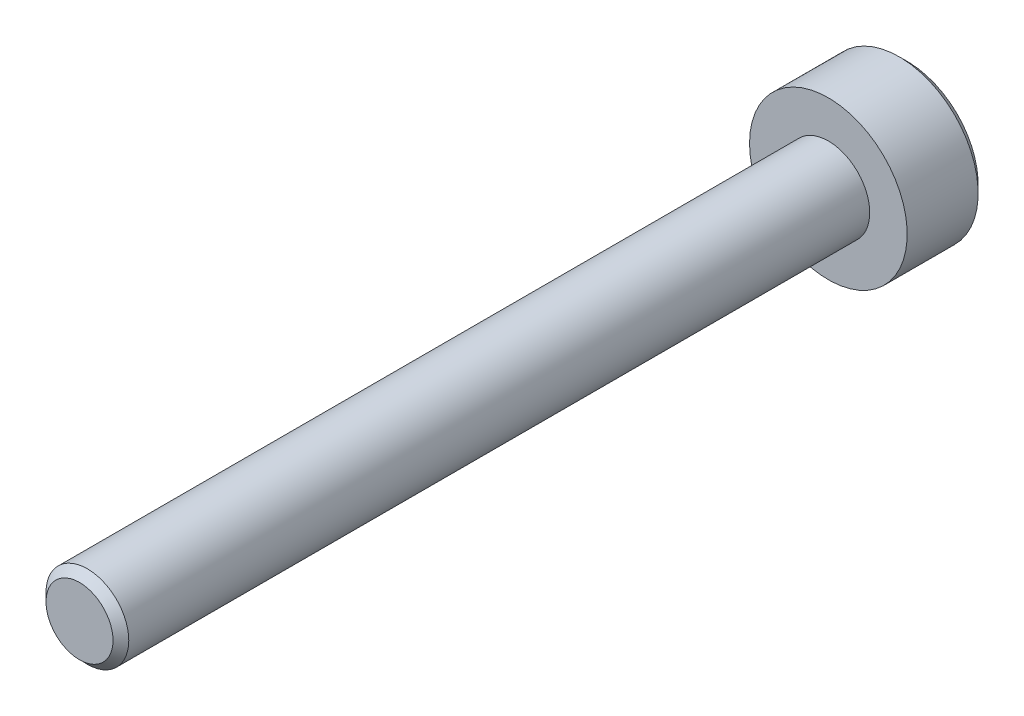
SolidWorks part; units mm, degrees
ref_plane "Plan de face" through (0, 0, 0) normal (0, 0, 1) x (1, 0, 0)
ref_plane "Plan de dessus" through (0, 0, 0) normal (0, 1, 0) x (1, 0, 0)
ref_plane "Plan de droite" through (0, 0, 0) normal (1, 0, 0) x (0, 0, -1)
sketch "Esquisse1" plane through (0, 0, 0) normal (0, 0, 1) x (1, 0, 0)
  circle A0 centre (0, 0) radius 5.25
  dimension "D1" = 10.5
extrude "Boss.-Extru.1" add sketch "Esquisse1" along normal blind 95
sketch "Esquisse2" plane through (0, 0, 0) normal (0, 0, -1) x (-1, 0, 0)
  circle A0 centre (0, 0) radius 10
  dimension "D1" = 20
extrude "Boss.-Extru.2" add sketch "Esquisse2" along normal blind 10
chamfer "Chanfrein1" distance 1 angle 45 2 edges at (-10, 0, -10) (5.25, 0, 95)
